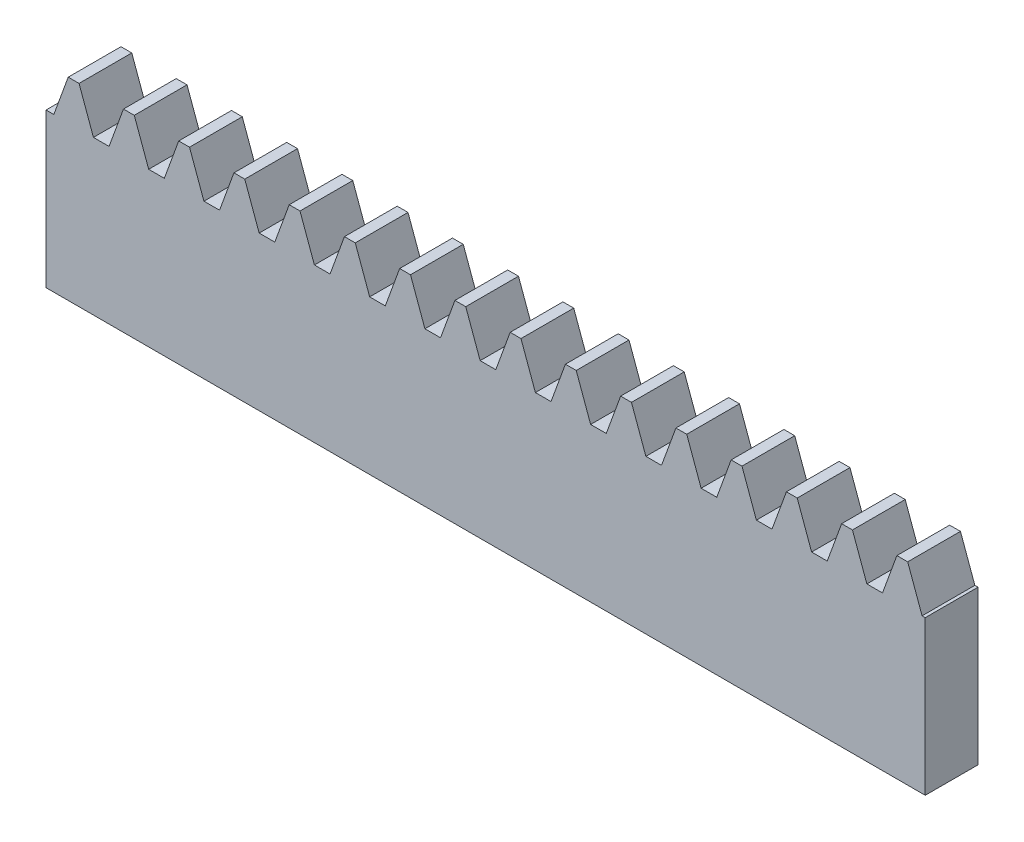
SolidWorks part; units mm, degrees
extrude "Blank" add sketch "BlankSke" against normal blind 3
sketch "BlankSke" plane through (0, 0, 0) normal (0, 0, 1) x (1, 0, 0)
  line L1 (0, 0) -> (50, 0)
  line L2 (0, 0) -> (0, 11)
  line L3 (0, 11) -> (50, 11)
  line L4 (50, 0) -> (50, 11)
ref_plane "Plane1" through (0, 0, 0) normal (0, 0, 1) x (1, 0, 0)
ref_plane "Plane2" through (0, 0, 0) normal (0, 1, 0) x (1, 0, 0)
ref_plane "Plane3" through (0, 0, 0) normal (1, 0, 0) x (0, 0, -1)
sketch "HoldingSke" plane through (0, 0, 0) normal (0, 1, 0) x (1, 0, 0)
  line L0 (0, 0) -> (0.1392, 0.9903)
  line L1 (-15, 0) -> (100, 0) construction
  line L2 (0, 0) -> (-2.1039, 2.3779)
  line L3 (0, 0) -> (-11.863, 4.5341)
  line L4 (0, 0) -> (8.2587, 2.5249)
  line L5 (0, 0) -> (-23.7986, -8.8762)
  line L6 (0, 0) -> (-10.5278, -7.1032)
  line L9 (-71.009, 38.7566) -> (-24.0243, 55.8576)
  line L10 (-76.2, 3.3779) -> (-66.2, 3.3779)
  line L11 (0, 0) -> (-3, 0)
  line L12 (-76.2, 101.6) -> (-76.162, 101.6)
  line L13 (24.9733, 27.94) -> (52.9518, 28.4284)
  line L14 (24.9733, 27.94) -> (24.9743, 27.94)
  line L15 (24.9733, 27.94) -> (100.4006, 29.5858)
  circle A0 centre (0, 0) radius 19.05
  circle A1 centre (0, 0) radius 5
  circle A2 centre (0, 0) radius 12.7
sketch "TooCutSkeIll" plane through (0, 0, 0) normal (0, 0, 1) x (1, 0, 0)
  line L0 (-1.2538, 10.9737) -> (-0.5045, 8.9152)
  line L1 (-0.2687, 8.75) -> (0.2687, 8.75)
  line L2 (0.5045, 8.9152) -> (1.2538, 10.9737)
  line L3 (50, 11) -> (0, 11) construction
  line L4 (0, 0) -> (0, 64.897) construction
  line L5 (-13.208, 10) -> (12.954, 10) construction
  line L6 (0, 0) -> (50, 0) construction
  line L7 (0.8994, 10) -> (0.8994, 48.7463) construction
  line L8 (-0.8994, 10) -> (-0.8994, 48.7463) construction
  line L9 (1.2914, 11) -> (1.2914, 11.0254)
  line L10 (-1.2914, 11) -> (-1.2914, 11.0254)
  line L11 (-1.2914, 11.0254) -> (1.2914, 11.0254)
  arc A0 (0.2687, 8.75) -> (0.5045, 8.9152) centre (0.2687, 9.001) ccw
  arc A1 (-0.5045, 8.9152) -> (-0.2687, 8.75) centre (-0.2687, 9.001) ccw
  arc A2 (1.2914, 11) -> (1.2538, 10.9737) centre (1.2914, 10.96) ccw
  arc A3 (-1.2538, 10.9737) -> (-1.2914, 11) centre (-1.2914, 10.96) ccw
extrude "ToothCutIll" [suppressed] cut sketch "TooCutSkeIll" against normal through all
sketch "TooCutSkeSim" plane through (0, 0, 0) normal (0, 0, 1) x (1, 0, 0)
  line L0 (0.4444, 8.75) -> (-0.4444, 8.75)
  line L1 (1.2726, 11.0254) -> (0.4444, 8.75)
  line L2 (0, 17.4625) -> (0, 53.467) construction
  line L3 (1.2726, 11.0254) -> (-1.2726, 11.0254)
  line L6 (-1.2726, 11.0254) -> (-0.4444, 8.75)
  line L9 (-0.8994, 10) -> (0.8994, 10) construction
  line L10 (0, 0) -> (50, 0) construction
  line L11 (0.8994, 10) -> (0.8994, 53.467) construction
  line L12 (-0.8994, 10) -> (-0.8994, 53.467) construction
extrude "ToothCutSim" cut sketch "TooCutSkeSim" against normal through all
pattern_linear "TeethCuts" count 17 spacing 3.1416 along (1, 0, 0) of "ToothCutIll", "ToothCutSim"
equation "' \"Module@HoldingSke\" = 6.35"
equation "' \"Num_teeth@HoldingSke\" = 12"
equation "' \"Ap@HoldingSke\" =  20"
equation "' \"Ap@HoldingSke\" = 20"
equation "' \"Width@HoldingSke\" = 0.25 * 25.4"
equation "' \"Show_teeth@HoldingSke\" = 500"
equation "' \"Backlash@HoldingSke\" = 0.009 * 25.4"
equation "' \"Addendum_fac@HoldingSke\" = 1.0"
equation "' \"Dedendum_fac@HoldingSke\" = 1.25"
equation "' \"Dedendum_add@HoldingSke\" = 0.00005 * 25.4"
equation "' \"Clearance_fac@HoldingSke\" = 0.25"
equation "' \"Pitch_height@HoldingSke\" = 1 * 25.4"
equation "' \"Length@HoldingSke\" = 4.71 * 25.4"
equation "\"Pitch@HoldingSke\" = 1 / \"Module@HoldingSke\""
equation "\"MPH@HoldingSke\" = \"Dedendum_fac@HoldingSke\" / \"Pitch@HoldingSke\" + 2 * \"Dedendum_add@HoldingSke\" + 0.002 * 25.4"
equation "\"MPH@HoldingSke\" = ((sgn( \"MPH@HoldingSke\" - \"Pitch_height@HoldingSke\")+1)*( \"MPH@HoldingSke\" - \"Pitch_height@HoldingSke\"))/2 + \"Pitch_height@HoldingSke\""
equation "\"Blank_height@BlankSke\" = \"Pitch_height@HoldingSke\" + \"Addendum_fac@HoldingSke\"  / \"Pitch@HoldingSke\" "
equation "\"Length@BlankSke\" =  \"Length@HoldingSke\""
equation "\"Face_width@Blank\" = \"Width@HoldingSke\""
equation "\"Pressure_angle@TooCutSkeIll\" = \"Ap@HoldingSke\""
equation "\"Addendum_plus@TooCutSkeIll\" =  \"Addendum_fac@HoldingSke\"  / \"Pitch@HoldingSke\" + 0.001 *25.4"
equation "\"Dedendum@TooCutSkeIll\" = \"Dedendum_fac@HoldingSke\"  / \"Pitch@HoldingSke\""
equation "\"Pitch_height@TooCutSkeIll\" =  \"MPH@HoldingSke\""
equation "\"Gap_width@TooCutSkeIll\" = 3.14159265 / 2 / \"Pitch@HoldingSke\" + 6 * \"Backlash@HoldingSke\""
equation "\"Pressure_angle@TooCutSkeSim\" = \"Ap@HoldingSke\""
equation "\"Addendum_plus@TooCutSkeSim\" =  \"Addendum_fac@HoldingSke\"  / \"Pitch@HoldingSke\" + 0.001 * 25.4"
equation "\"Dedendum@TooCutSkeSim\" = \"Dedendum_fac@HoldingSke\"  / \"Pitch@HoldingSke\""
equation "\"Pitch_height@TooCutSkeSim\" =  \"MPH@HoldingSke\""
equation "\"Gap_width@TooCutSkeSim\" = 3.14159265 / 2 / \"Pitch@HoldingSke\" + 6 * \"Backlash@HoldingSke\""
equation "\"Root_fillet@TooCutSkeIll\" = \"Clearance_fac@HoldingSke\" / \"Pitch@HoldingSke\" + \"Dedendum_add@HoldingSke\""
equation "\"Break_rad@TooCutSkeIll\" = 0.02 / \"Pitch@HoldingSke\" * 2"
equation "\"Linear_pitch@TeethCuts\" = 3.14159265 / \"Pitch@HoldingSke\""
equation "\"Num_teeth@HoldingSke\" = int( ( \"Length@HoldingSke\" + 0 ) / (3.14159265 / \"Pitch@HoldingSke\")) + 0.9999  + 1"
equation " \"Num_teeth@TeethCuts\" = int( \"Show_teeth@HoldingSke\" ) + 1"
equation " \"Num_teeth@TeethCuts\" = ((sgn( \"Num_teeth@TeethCuts\" - \"Num_teeth@HoldingSke\" )-1)*( \"Num_teeth@TeethCuts\" - \"Num_teeth@HoldingSke\" ))/-2+ \"Num_teeth@HoldingSke\""
equation " \"Num_teeth@TeethCuts\" = ((sgn( \"Num_teeth@TeethCuts\" - 2.0)+1)*( \"Num_teeth@TeethCuts\" - 2.0))/2 +2.0"
